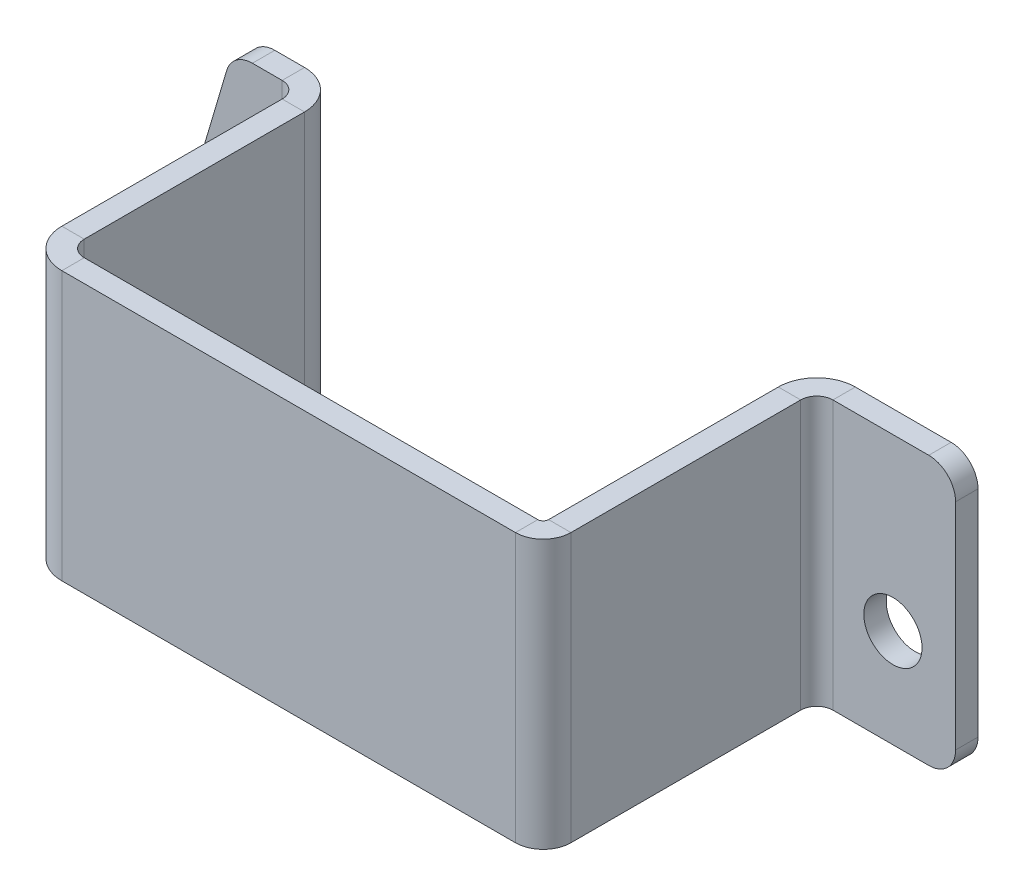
SolidWorks part; units mm, degrees
ref_plane "Plan1" through (0, 0, 0) normal (0, 0, 1) x (1, 0, 0)
ref_plane "Plan2" through (0, 0, 0) normal (0, 1, 0) x (1, 0, 0)
ref_plane "Plan3" through (0, 0, 0) normal (1, 0, 0) x (0, 0, -1)
sketch "Esquisse1" plane through (0, 0, 0) normal (0, 0, 1) x (1, 0, 0)
  line L0 (133.5398, 50) -> (133.5398, -30) construction
  line L1 (4.0165, 0) -> (147.1398, 0)
  line L2 (103.1398, 50) -> (103.1398, -30) construction
  line L3 (11.1193, 30) -> (147.1398, 30)
  line L4 (150.1398, 3) -> (150.1398, 27)
  line L5 (1.1398, 3.8513) -> (8.2426, 27.8513)
  line L6 (47.7398, 50) -> (47.7398, -30) construction
  line L7 (17.3398, 50) -> (17.3398, -30) construction
  circle A0 centre (143.1398, 11) radius 3.25
  circle A1 centre (7.7398, 11) radius 3.25
  arc A2 (147.1398, 30) -> (150.1398, 27) centre (147.1398, 27) cw
  arc A3 (147.1398, 0) -> (150.1398, 3) centre (147.1398, 3) ccw
  arc A4 (1.1398, 3.8513) -> (4.0165, 0) centre (4.0165, 3) ccw
  arc A5 (11.1193, 30) -> (8.2426, 27.8513) centre (11.1193, 27) ccw
  point P11 (150.1398, 30)
  point P14 (150.1398, 0)
  point P17 (0, 0)
  point P20 (8.8785, 30)
  dimension "D2" = 6.5
  dimension "D3" = 135.4
  dimension "D9" = 3
  dimension "D1" = 4.3
  dimension "D4" = 7
  dimension "D5" = 11
  dimension "D6" = 30
  dimension "D7" = 9.6
  dimension "D8" = 149
  dimension "D10" = 30.4
  dimension "D11" = 30.4
  dimension "D13" = 9.6
extrude "Base-Extrusion" add sketch "Esquisse1" along normal blind 2.5
sheet metal parameters "Tôlerie 3" parameters "D1"=1, "Epaisseur"=4
flatten bends "Dépliage 8" parameters "D1"=0
sketch "Esquisse-Angle8" plane through (0, 0, 0) normal (0, 0, -1) x (-1, 0, 0)
process bends "Pliage 8" parameters "D1"=1.8
sketch "Esquisse-Plate8" plane through (0, 0, 0) normal (0, 0, -1) x (-1, 0, 0)
  line L0 (-133.5398, 50) -> (-133.5398, -20)
  line L1 (-103.1398, 50) -> (-103.1398, -20)
  line L2 (-47.7398, 50) -> (-47.7398, -20)
  line L3 (-17.3398, 50) -> (-17.3398, -20)
  line L5 (-75.4398, -40) -> (-75.4398, 100) construction
  circle A1 centre (-143.1398, 11) radius 3.25 construction
  circle A2 centre (-7.7398, 11) radius 3.25 construction
  point P8 (-53.7398, 15)
  dimension "D1" = 9.6
  dimension "D2" = 30.4
bend "Pli défini à plat8" bend radius 0.6 bend angle 90 parameters "D5"=1
bend "Pli défini à plat9" bend angle 90 parameters "D1"=0, "D5"=2
bend "Pli défini à plat10" bend radius 1 bend angle 90 parameters "D5"=3
bend "Pli défini à plat11" bend radius 1 bend angle 90 parameters "D5"=4
equation "\"D13@Esquisse1\" = \"D7@Esquisse1\""
equation "\"D11@Esquisse1\" = \"D10@Esquisse1\""
